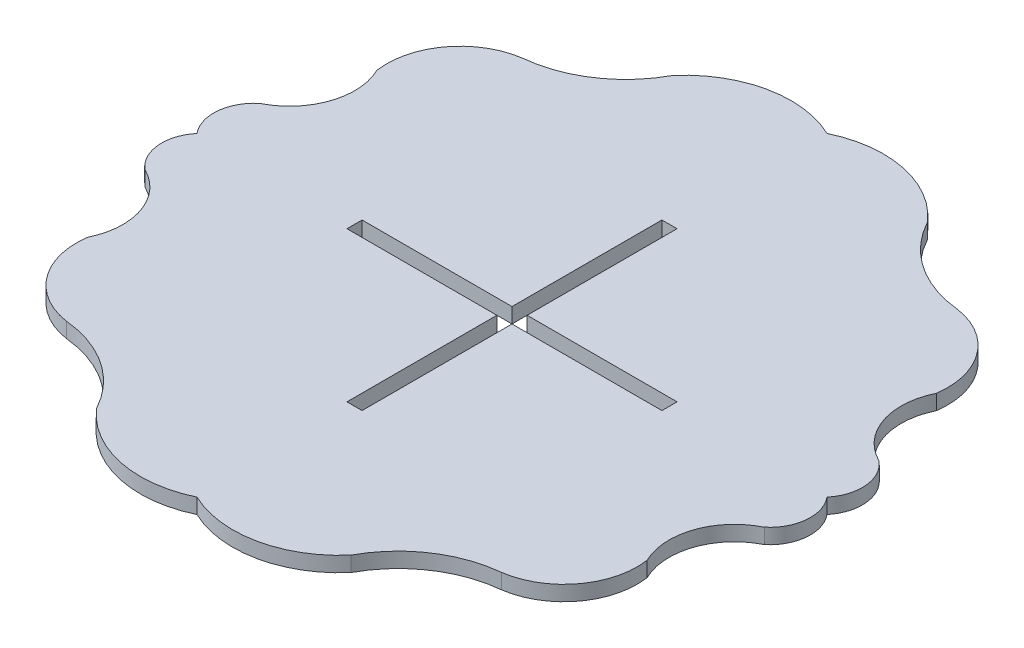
SolidWorks part; units mm, degrees
ref_plane "Front Plane" through (0, 0, 0) normal (0, 0, 1) x (1, 0, 0)
ref_plane "Top Plane" through (0, 0, 0) normal (0, 1, 0) x (1, 0, 0)
ref_plane "Right Plane" through (0, 0, 0) normal (1, 0, 0) x (0, 0, -1)
sketch "Sketch1" plane through (0, 0, 0) normal (0, 1, 0) x (1, 0, 0)
  line L0 (0, 250) -> (0, 125) construction
  line L1 (-250, 0) -> (-125, 0) construction
  line L2 (6, 6) -> (125, 6)
  line L3 (-6, 125) -> (6, 125)
  line L4 (-6, 125) -> (-6, 6)
  line L5 (-6, -125) -> (6, -125)
  line L6 (6, 125) -> (6, 6)
  line L7 (-125, 6) -> (-6, 6)
  line L8 (-125, 6) -> (-125, -6)
  line L9 (-125, -6) -> (-6, -6)
  line L10 (125, 6) -> (125, -6)
  line L12 (6, -6) -> (6, -125)
  line L13 (-6, -6) -> (-6, -125)
  line L15 (6, -6) -> (125, -6)
  line L16 (0, -125) -> (0, -250) construction
  line L17 (6, 0) -> (250, 0) construction
  arc A1 (0, 250) -> (-101.0176, 228.682) centre (-36.6461, 173.6513) ccw
  arc A2 (-101.0176, 228.682) -> (-172.5469, 180.9077) centre (-181.5072, 271.7585) cw
  arc A3 (-172.5469, 180.9077) -> (-222.0477, 114.8688) centre (-164.2778, 123.1378) ccw
  arc A4 (-222.0477, 114.8688) -> (-245.823, 45.5087) centre (-268.6154, 92.0764) cw
  arc A5 (-245.823, 45.5087) -> (-250, 0) centre (-225.1572, 20.6659) ccw
  arc A6 (245.823, 45.5087) -> (250, 0) centre (225.1572, 20.6659) cw
  arc A7 (222.0477, 114.8688) -> (245.823, 45.5087) centre (268.6154, 92.0764) ccw
  arc A8 (172.5469, 180.9077) -> (222.0477, 114.8688) centre (164.2778, 123.1378) cw
  arc A9 (101.0176, 228.682) -> (172.5469, 180.9077) centre (181.5072, 271.7585) ccw
  arc A10 (0, 250) -> (101.0176, 228.682) centre (36.6461, 173.6513) cw
  arc A11 (245.823, -45.5087) -> (250, 0) centre (225.1572, -20.6659) ccw
  arc A12 (222.0477, -114.8688) -> (245.823, -45.5087) centre (268.6154, -92.0764) cw
  arc A13 (172.5469, -180.9077) -> (222.0477, -114.8688) centre (164.2778, -123.1378) ccw
  arc A14 (101.0176, -228.682) -> (172.5469, -180.9077) centre (181.5072, -271.7585) cw
  arc A15 (0, -250) -> (101.0176, -228.682) centre (36.6461, -173.6513) ccw
  arc A16 (-245.823, -45.5087) -> (-250, 0) centre (-225.1572, -20.6659) cw
  arc A17 (-222.0477, -114.8688) -> (-245.823, -45.5087) centre (-268.6154, -92.0764) ccw
  arc A18 (-172.5469, -180.9077) -> (-222.0477, -114.8688) centre (-164.2778, -123.1378) cw
  arc A19 (-101.0176, -228.682) -> (-172.5469, -180.9077) centre (-181.5072, -271.7585) ccw
  arc A20 (0, -250) -> (-101.0176, -228.682) centre (-36.6461, -173.6513) cw
  dimension "D2" = 6
  dimension "D3" = 12
  dimension "D4" = 250
  dimension "D5" = 125
  dimension "D6" = 6
  dimension "D7" = 12
  dimension "D8" = 250
  dimension "D9" = 125
extrude "Boss-Extrude1" add sketch "Sketch1" along normal blind 12
